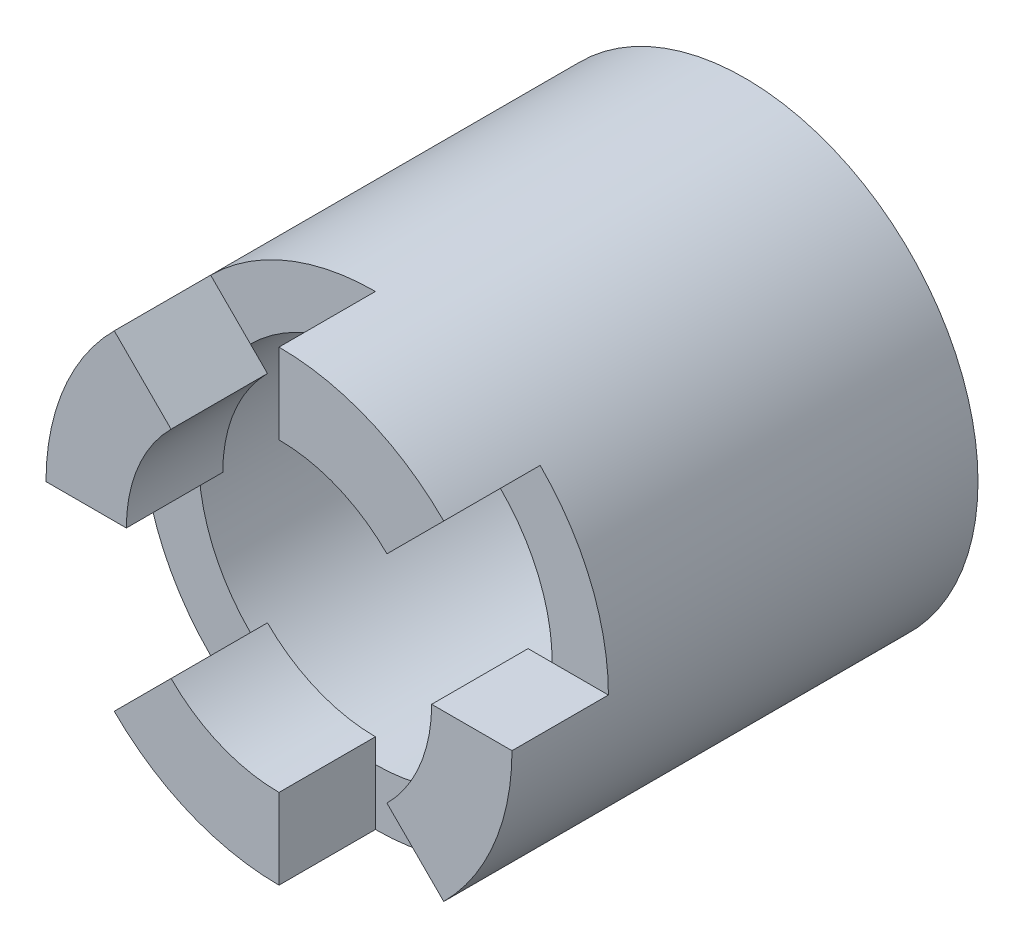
SolidWorks part; units mm, degrees
ref_plane "Front Plane" through (0, 0, 0) normal (0, 0, 1) x (1, 0, 0)
ref_plane "Top Plane" through (0, 0, 0) normal (0, 1, 0) x (1, 0, 0)
ref_plane "Right Plane" through (0, 0, 0) normal (1, 0, 0) x (0, 0, -1)
sketch "Sketch1" plane through (0, 0, 0) normal (0, 0, 1) x (1, 0, 0)
  circle A0 centre (0, 0) radius 7.25
  dimension "D1" = 14.5
extrude "Boss-Extrude1" add sketch "Sketch1" along normal blind 11.5
sketch "Sketch2" plane through (0, 0, 11.5) normal (0, 0, 1) x (1, 0, 0)
  circle A0 centre (0, 0) radius 5.5
  dimension "D1" = 11
extrude "Cut-Extrude1" cut sketch "Sketch2" against normal blind 9
sketch "Sketch3" plane through (0, 0, 11.5) normal (0, 0, 1) x (1, 0, 0)
  line L0 (0, 7.25) -> (0, 4.75)
  line L1 (-7.25, 0) -> (-4.75, 0)
  line L2 (-5.1265, 5.1265) -> (-3.3588, 3.3588)
  line L3 (-5.1265, -5.1265) -> (-3.3588, -3.3588)
  line L4 (0, -4.75) -> (0, -7.25)
  line L5 (3.3588, -3.3588) -> (5.1265, -5.1265)
  line L6 (4.75, 0) -> (7.25, 0)
  line L7 (3.3588, 3.3588) -> (5.1265, 5.1265)
  arc A0 (-5.1265, 5.1265) -> (-7.25, 0) centre (0, 0) ccw
  arc A1 (-3.3588, 3.3588) -> (-4.75, 0) centre (0, 0) ccw
  arc A2 (5.1265, 5.1265) -> (0, 7.25) centre (0, 0) ccw
  arc A3 (3.3588, -3.3588) -> (4.75, 0) centre (0, 0) ccw
  arc A4 (5.1265, -5.1265) -> (7.25, 0) centre (0, 0) ccw
  arc A5 (3.3588, 3.3588) -> (0, 4.75) centre (0, 0) ccw
  arc A6 (-3.3588, -3.3588) -> (0, -4.75) centre (0, 0) ccw
  arc A7 (-5.1265, -5.1265) -> (0, -7.25) centre (0, 0) ccw
  dimension "D1" = 14.5
  dimension "D2" = 9.5
  dimension "D3" = 45
  dimension "D4" = 45
extrude "Boss-Extrude2" add sketch "Sketch3" along normal blind 3
